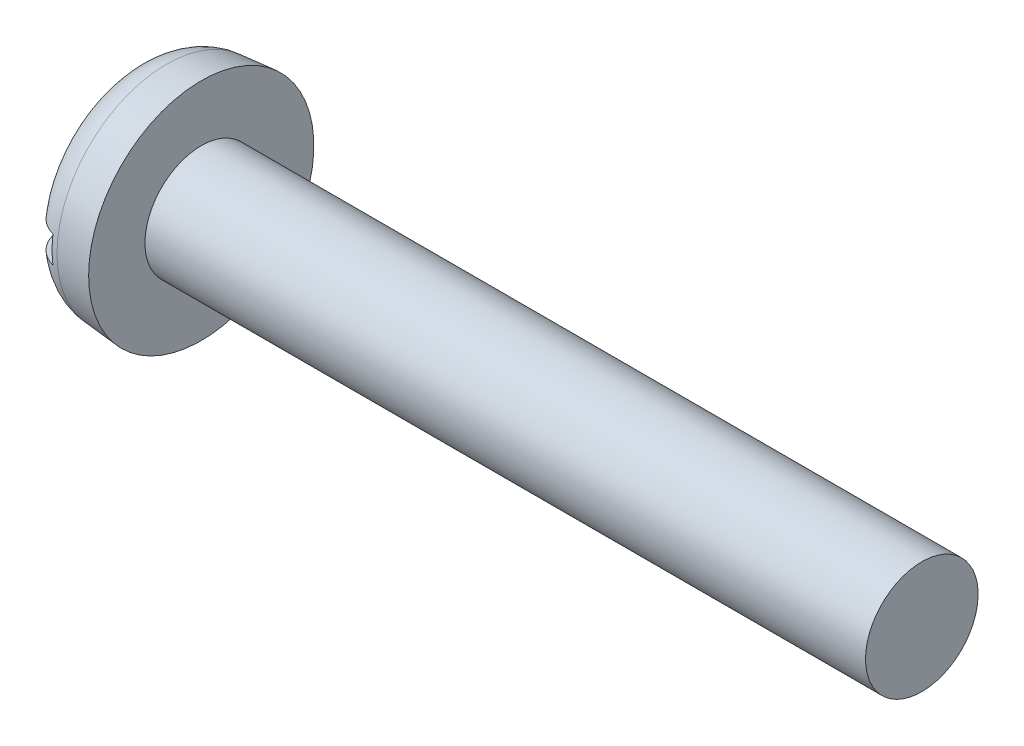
SolidWorks part; units mm, degrees
ref_plane "Plane1" through (0, 0, 0) normal (0, 0, 1) x (1, 0, 0)
ref_plane "Plane2" through (0, 0, 0) normal (0, 1, 0) x (1, 0, 0)
ref_plane "Plane3" through (0, 0, 0) normal (1, 0, 0) x (0, 0, -1)
sketch "BodySke" plane through (0, 0, 0) normal (0, 0, 1) x (1, 0, 0)
  line L0 (1.5, 1.25) -> (1.5, 2.5)
  line L1 (0, 0) -> (0, 2.3688)
  line L2 (-25.4, 0) -> (127, 0) construction
  line L3 (17.5, 0) -> (0, 0)
  line L4 (1.5, 1.25) -> (17.5, 1.25)
  line L5 (17.5, 1.25) -> (17.5, 0)
  line L6 (0, 2.3688) -> (1.5, 2.5)
  line L9 (1.95, 2.8375) -> (1.95, -6.6875) construction
  line L10 (1.5, 6.35) -> (1.5, -3.175) construction
  dimension "Head_ht" = 1.5
  dimension "Diameter" = 2.5
  dimension "Length" = 16
  dimension "Head_dia" = 5
  dimension "Advance" = 0.45
  dimension "Thread_nom" = 16
  dimension "Head_side_angle" = 5
revolve "Base-Revolve" add sketch "BodySke"
fillet "Fillet1" [suppressed] radius 0.1
fillet "Fillet2" radius 0.8 1 edges at (0, 0, 2.3688)
sketch "Sketch2" plane through (0, 0, 0) normal (1, 0, 0) x (0, 0, -1)
  line L0 (2.5, -0.3) -> (-2.5, -0.3)
  line L1 (2.5, -0.3) -> (2.5, 0.3)
  line L2 (-2.5, 0.3) -> (2.5, 0.3)
  line L3 (-2.5, 0.3) -> (-2.5, -0.3)
  dimension "D1" = 5
  dimension "D2" = 2.5
  dimension "Slot_width" = 0.6
  dimension "D3" = 0.3
extrude "Slot" cut sketch "Sketch2" along normal blind 0.6
sketch "ThdSchSke" plane through (0, 0, 0) normal (0, 0, 1) x (1, 0, 0)
  line L0 (2.4, -0.9965) -> (2.2225, -1.25)
  line L1 (2.4, -0.9965) -> (2.5775, -1.25)
  line L2 (2.5775, -1.25) -> (2.5775, -1.5625)
  line L3 (-3.175, 0) -> (5.1513, 0) construction
  line L5 (2.5775, -1.5625) -> (2.2225, -1.5625)
  line L6 (2.2225, -1.5625) -> (2.2225, -1.25)
  dimension "Thread_minor" = 1.993
  dimension "Diameter" = 2.5
  dimension "Start" = 2.4
  dimension "SideAngle" = 55
  dimension "VeeAngle" = 70
  dimension "Overcut" = 3.125
revolve "ThreadSchematic" [suppressed] cut sketch "ThdSchSke" angle 360 about L3
pattern_linear "ThdSchPat" [suppressed]
equation "\"D1@Sketch2\" = \"Head_dia@BodySke\""
equation "\"D2@Sketch2\" = \"D1@Sketch2\" / 2"
equation "\"D3@Sketch2\" = \"Slot_width@Sketch2\" / 2"
equation "\"Thread_length@ThreadCosmetic\" = ((sgn( (\"Length@BodySke\" - \"Advance@BodySke\" * 2.0 ) - \"Thread_nom@BodySke\" )-1)*( (\"Length@BodySke\" - \"Advance@BodySke\"  * 2.0) - \"Thread_nom@BodySke\" ))/-2+ \"Thread_"
equation "\"Thread_minor@ThdSchSke\" = \"Thread_minor@ThreadCosmetic\""
equation "\"Diameter@ThdSchSke\" = \"Diameter@BodySke\""
equation "\"Overcut@ThdSchSke\" = \"Diameter@BodySke\" * 1.25"
equation "\"Start@ThdSchSke\" = \"Head_ht@BodySke\" + \"Length@BodySke\" - \"Thread_length@ThreadCosmetic\"  '---Non-countersunk---"
equation "\"Num_threads@ThdSchPat\" = int( \"Thread_length@ThreadCosmetic\" / \"Advance@BodySke\" + 0.999 )  + 1"
equation "\"Advance@ThdSchPat\" = \"Thread_length@ThreadCosmetic\" /  (\"Num_threads@ThdSchPat\" - 1) 'relax it"
